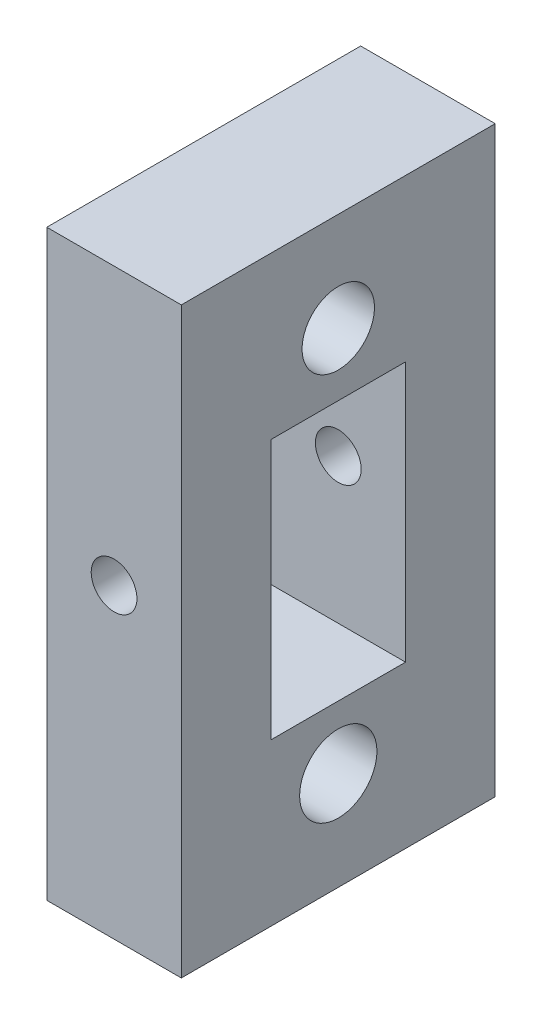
SolidWorks part; units mm, degrees
ref_plane "Plan de face" through (0, 0, 0) normal (0, 0, 1) x (1, 0, 0)
ref_plane "Plan de dessus" through (0, 0, 0) normal (0, 1, 0) x (1, 0, 0)
ref_plane "Plan de droite" through (0, 0, 0) normal (1, 0, 0) x (0, 0, -1)
sketch "Esquisse1" plane through (0, 0, 0) normal (0, 0, 1) x (1, 0, 0)
  line L1 (-67.6213, 30.8432) -> (-52.6213, 30.8432)
  line L2 (-67.6213, 30.8432) -> (-67.6213, -34.1568)
  line L3 (-67.6213, -34.1568) -> (-52.6213, -34.1568)
  line L4 (-52.6213, 30.8432) -> (-52.6213, -34.1568)
  dimension "D1" = 65
  dimension "D2" = 15
extrude "Boss.-Extru.1" add sketch "Esquisse1" along normal blind 10
sketch "Esquisse2" plane through (0, 0, 0) normal (0, 0, -1) x (-1, 0, 0)
  line L0 (52.6213, 30.8432) -> (67.6213, 30.8432) construction
  line L1 (52.6213, 30.8432) -> (67.6213, 30.8432)
  line L2 (52.6213, 30.8432) -> (52.6213, 12.8432)
  line L3 (52.6213, 12.8432) -> (67.6213, 12.8432)
  line L4 (67.6213, 30.8432) -> (67.6213, 12.8432)
  line L5 (52.6213, -34.1568) -> (52.6213, 30.8432) construction
  line L6 (67.6213, 30.8432) -> (67.6213, -34.1568) construction
  dimension "D1" = 0
  dimension "D2" = 0
  dimension "D3" = 0
  dimension "D4" = 18
extrude "Boss.-Extru.2" add sketch "Esquisse2" along normal blind 15
sketch "Esquisse3" plane through (0, 0, 0) normal (0, 0, -1) x (-1, 0, 0)
  line L0 (52.6213, -34.1568) -> (52.6213, 12.8432) construction
  line L1 (52.6213, -16.1568) -> (67.6213, -16.1568)
  line L2 (52.6213, -16.1568) -> (52.6213, -34.1568)
  line L3 (52.6213, -34.1568) -> (67.6213, -34.1568)
  line L4 (67.6213, -16.1568) -> (67.6213, -34.1568)
  dimension "D1" = 18
extrude "Boss.-Extru.3" add sketch "Esquisse3" along normal blind 15
sketch "Esquisse4" plane through (0, 0, -15) normal (0, 0, -1) x (-1, 0, 0)
  line L1 (52.6213, 30.8432) -> (67.6213, 30.8432)
  line L2 (52.6213, 30.8432) -> (52.6213, -34.1568)
  line L3 (52.6213, -34.1568) -> (67.6213, -34.1568)
  line L4 (67.6213, 30.8432) -> (67.6213, -34.1568)
extrude "Boss.-Extru.4" add sketch "Esquisse4" along normal blind 10
sketch "Esquisse5" plane through (-67.6213, 0, 0) normal (-1, 0, 0) x (0, 0, 1)
  line L0 (10, 30.8432) -> (-25, 30.8432) construction
  line L1 (10, -34.1568) -> (-25, -34.1568) construction
  line L2 (0, 12.8432) -> (0, -16.1568) construction
  circle A0 centre (-7.5, 19.8432) radius 4.0373
  circle A1 centre (-7.5, -23.1568) radius 4.3086
  dimension "D1" = 43
  dimension "D2" = 11
  dimension "D3" = 11
  dimension "D4" = 7.5
extrude "Enlèv. mat.-Extru.1" cut sketch "Esquisse5" against normal through all
sketch "Esquisse7" plane through (0, 0, 0) normal (0, 0, -1) x (-1, 0, 0)
  line L0 (67.6213, 12.8432) -> (67.6213, -16.1568) construction
  line L1 (52.6213, -16.1568) -> (52.6213, 12.8432) construction
  circle A0 centre (60.1213, 0) radius 2.55
  dimension "D1" = 5.1
  dimension "D2" = 7.5
  dimension "D3" = 7.5
extrude "Enlèv. mat.-Extru.2" cut sketch "Esquisse7" along normal through all and the other way through all
